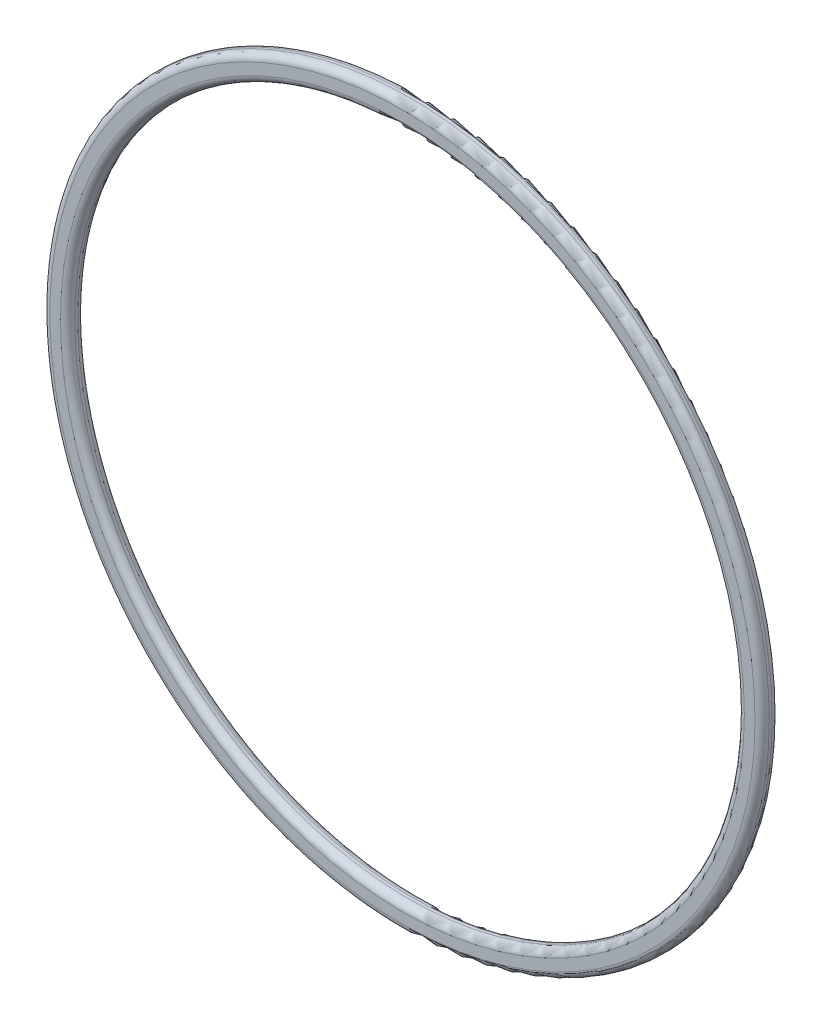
SolidWorks part; units mm, degrees
ref_plane "Plan de face" through (0, 0, 0) normal (0, 0, 1) x (1, 0, 0)
ref_plane "Plan de dessus" through (0, 0, 0) normal (0, 1, 0) x (1, 0, 0)
ref_plane "Plan de droite" through (0, 0, 0) normal (1, 0, 0) x (0, 0, -1)
sketch "Esquisse1" plane through (0, 0, 0) normal (1, 0, 0) x (0, 0, -1)
  line L0 (-20.8244, 0) -> (21.7431, 0) construction
  line L2 (1.4594, 50.5) -> (1.8594, 50.5)
  line L3 (0.4594, 49.5) -> (0.4594, 48)
  line L4 (1.4594, 47) -> (1.8594, 47)
  line L5 (2.8594, 49.5) -> (2.8594, 48)
  arc A0 (1.8594, 47) -> (2.8594, 48) centre (1.8594, 48) ccw
  arc A1 (1.8594, 50.5) -> (2.8594, 49.5) centre (1.8594, 49.5) cw
  arc A2 (1.4594, 50.5) -> (0.4594, 49.5) centre (1.4594, 49.5) ccw
  arc A3 (0.4594, 48) -> (1.4594, 47) centre (1.4594, 48) ccw
  dimension "D4" = 1
  dimension "D1" = 94
  dimension "D2" = 101
  dimension "D3" = 2.4
revolve "Révolution1" add sketch "Esquisse1" angle 360 about L0
